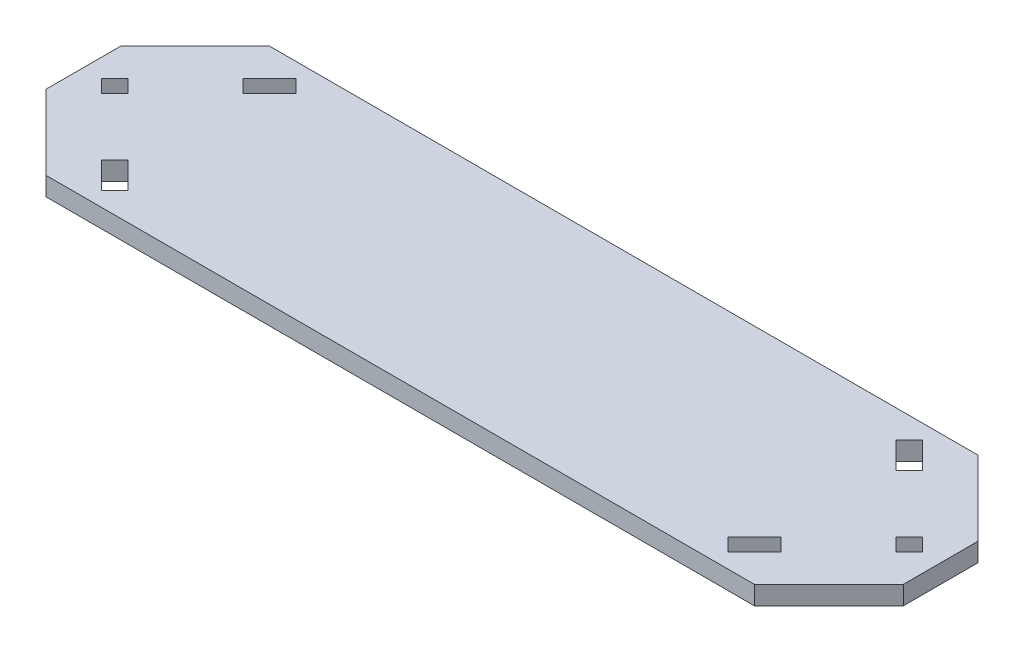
SolidWorks part; units mm, degrees
ref_plane "Front Plane" through (0, 0, 0) normal (0, 0, 1) x (1, 0, 0)
ref_plane "Top Plane" through (0, 0, 0) normal (0, 1, 0) x (1, 0, 0)
ref_plane "Right Plane" through (0, 0, 0) normal (1, 0, 0) x (0, 0, -1)
sketch "Sketch1" plane through (0, 0, 0) normal (0, 1, 0) x (1, 0, 0)
  line L0 (0, -747.0628) -> (0, 36606.076) construction
  line L1 (-747.0628, 0) -> (36606.076, 0) construction
  line L2 (-146.05, 38.1) -> (-146.05, -38.1)
  line L3 (146.05, -38.1) -> (146.05, 38.1)
  line L4 (-146.05, -38.1) -> (146.05, -38.1)
  line L7 (146.05, 38.1) -> (-146.05, 38.1)
  point P6 (146.05, 0)
  dimension "D2" = 76.2
  dimension "D3" = 292.1
extrude "Boss-Extrude1" add sketch "Sketch1" along normal blind 6.35
sketch "Sketch2" plane through (0, 6.35, 0) normal (0, 1, 0) x (1, 0, 0)
  line L0 (-200747.0628, 0) -> (236606.076, 0) construction
  line L1 (-120.65, 0) -> (-96.52, 0) construction
  line L2 (-96.52, 0) -> (-72.39, 0) construction
  line L3 (-72.39, 0) -> (-48.26, 0) construction
  line L4 (-48.26, 0) -> (-24.13, 0) construction
  line L5 (-24.13, 0) -> (0, 0) construction
  line L6 (0, 0) -> (24.13, 0) construction
  line L7 (24.13, 0) -> (48.26, 0) construction
  line L8 (48.26, 0) -> (72.39, 0) construction
  line L9 (72.39, 0) -> (96.52, 0) construction
  line L10 (96.52, 0) -> (120.65, 0) construction
  circle A0 centre (0, 0) radius 5.334
  circle A1 centre (-120.65, 0) radius 4.7625
  circle A2 centre (-96.52, 0) radius 4.7625
  circle A3 centre (-72.39, 0) radius 4.7625
  circle A4 centre (-48.26, 0) radius 4.7625
  circle A5 centre (-24.13, 0) radius 5.334
  circle A6 centre (24.13, 0) radius 5.334
  circle A7 centre (48.26, 0) radius 5.334
  circle A8 centre (72.39, 0) radius 4.826
  circle A9 centre (96.52, 0) radius 4.826
  circle A10 centre (120.65, 0) radius 4.826
  dimension "D2" = 9.525
  dimension "D3" = 10.668
  dimension "D4" = 9.652
  dimension "D1" = 24.13
extrude "Cut-Extrude1" [suppressed] cut sketch "Sketch2" against normal through all
chamfer "Chamfer1" distance 25.4 angle 45 4 edges at (146.05, 3.175, -38.1) (146.05, 3.175, 38.1) (-146.05, 3.175, -38.1) (-146.05, 3.175, 38.1)
sketch "Sketch3" plane through (0, 6.35, 0) normal (0, 1, 0) x (1, 0, 0)
  line L0 (-130.81, 0) -> (-102.235, 28.575) construction
  line L1 (-130.81, 0) -> (-102.235, -28.575) construction
  line L2 (-130.81, 0) -> (0, 0) construction
  line L3 (-130.81, 0) -> (-135.3001, -4.4901)
  line L4 (-135.3001, -4.4901) -> (-139.7903, 0)
  line L5 (-139.7903, 0) -> (-135.3001, 4.4901)
  line L6 (-135.3001, 4.4901) -> (-130.81, 0)
  line L7 (-102.235, -28.575) -> (-106.7251, -33.0651)
  line L8 (-106.7251, -33.0651) -> (-115.7054, -24.0849)
  line L9 (-115.7054, -24.0849) -> (-111.2153, -19.5947)
  line L10 (-111.2153, -19.5947) -> (-102.235, -28.575)
  line L11 (-102.235, 28.575) -> (-106.7251, 33.0651)
  line L12 (-106.7251, 33.0651) -> (-115.7054, 24.0849)
  line L13 (-115.7054, 24.0849) -> (-111.2153, 19.5947)
  line L14 (-111.2153, 19.5947) -> (-102.235, 28.575)
  dimension "D1" = 130.81
  dimension "D2" = 57.15
  dimension "D3" = 6.35
  dimension "D4" = 12.7
extrude "Cut-Extrude2" cut sketch "Sketch3" against normal through all
mirror "Mirror1" about plane through (0, 0, 0) normal (1, 0, 0) of "Cut-Extrude2"
equation "\"PlywoodThickness\"= .25in"
equation "\"D1@Boss-Extrude1\"=\"PlywoodThickness\""
equation "\"D3@Sketch3\"=\"PlywoodThickness\""
equation "\"D4@Sketch3\"=\"PlywoodThickness\"*2"
